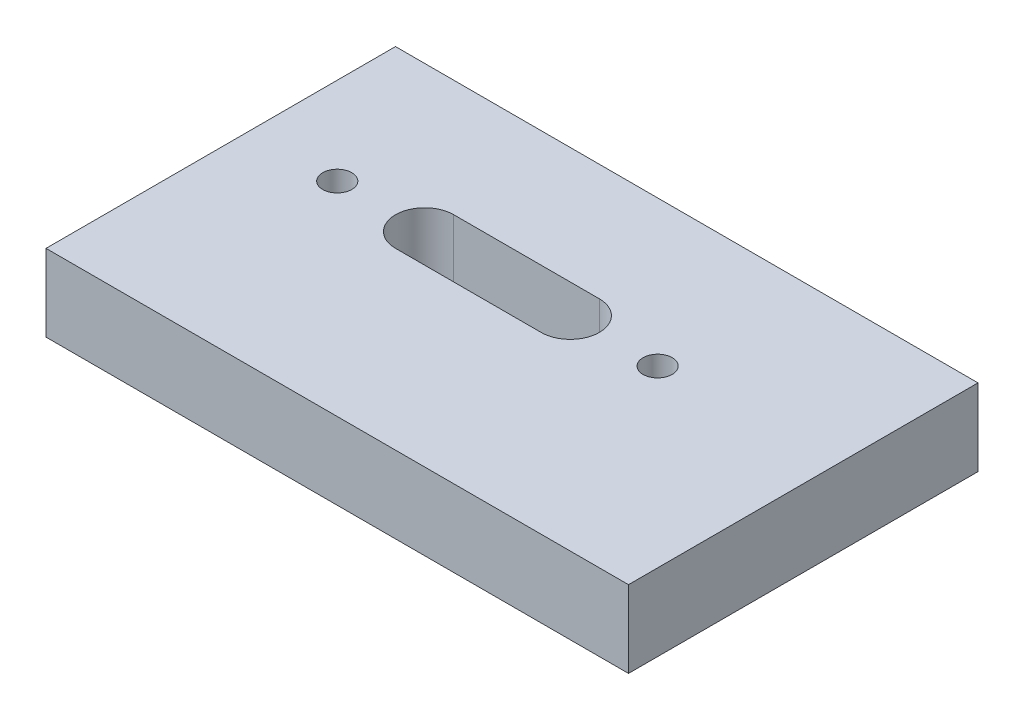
SolidWorks part; units mm, degrees
ref_plane "Front Plane" through (0, 0, 0) normal (0, 0, 1) x (1, 0, 0)
ref_plane "Top Plane" through (0, 0, 0) normal (0, 1, 0) x (1, 0, 0)
ref_plane "Right Plane" through (0, 0, 0) normal (1, 0, 0) x (0, 0, -1)
sketch "Sketch1" plane through (0, 0, 0) normal (0, 1, 0) x (1, 0, 0)
  line L1 (-63.5, -38.1) -> (63.5, -38.1)
  line L2 (-63.5, -38.1) -> (-63.5, 38.1)
  line L3 (-63.5, 38.1) -> (63.5, 38.1)
  line L4 (63.5, -38.1) -> (63.5, 38.1)
  line L5 (-63.5, -38.1) -> (63.5, 38.1) construction
  line L6 (-63.5, 38.1) -> (63.5, -38.1) construction
  point P0 (0, 0)
  dimension "D1" = 76.2
  dimension "D2" = 127
extrude "Boss-Extrude1" add sketch "Sketch1" along normal blind 16.764
sketch "Sketch2" plane through (0, 16.764, 0) normal (0, 1, 0) x (1, 0, 0)
  line L0 (-25.4, 6.35) -> (6.35, 6.35) construction
  line L1 (-25.4, 12.7) -> (6.35, 12.7)
  line L2 (-25.4, 0) -> (6.35, 0)
  line L3 (-9.525, 6.35) -> (-9.525, 18.0684) construction
  line L4 (63.5, 38.1) -> (-63.5, 38.1) construction
  line L5 (-63.5, 38.1) -> (-63.5, -38.1) construction
  arc A0 (-25.4, 12.7) -> (-25.4, 0) centre (-25.4, 6.35) ccw
  arc A1 (6.35, 0) -> (6.35, 12.7) centre (6.35, 6.35) ccw
  circle A2 centre (25.4, 6.35) radius 3.175
  circle A3 centre (-44.45, 6.35) radius 3.175
  point P3 (-9.525, 6.35)
  dimension "D1" = 6.35
  dimension "D3" = 6.35
  dimension "D2" = 31.75
  dimension "D4" = 19.05
  dimension "D5" = 31.75
  dimension "D6" = 38.1
extrude "Cut-Extrude1" cut sketch "Sketch2" against normal through all
